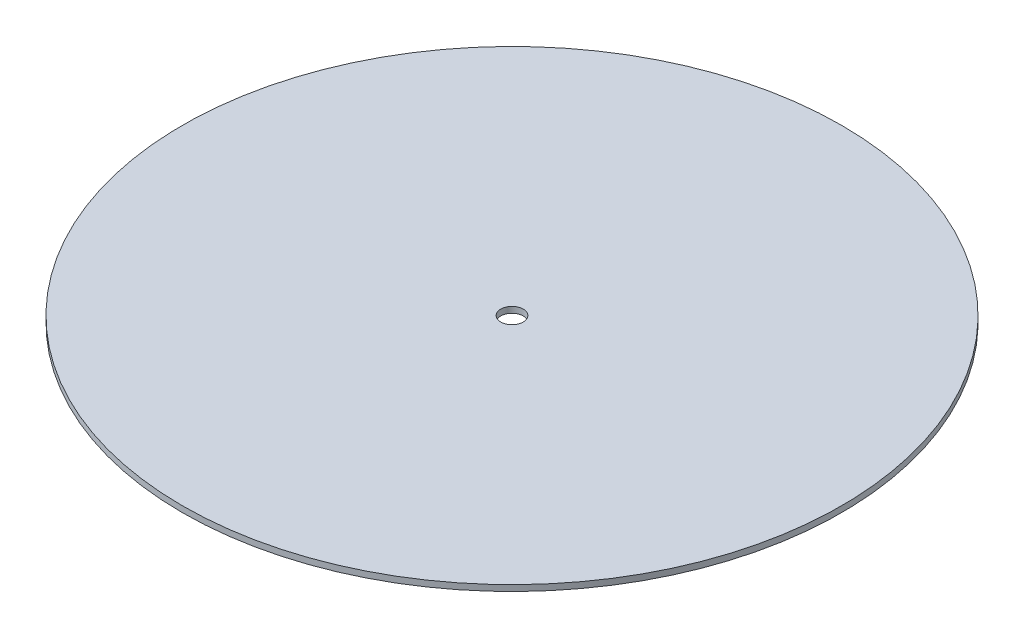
SolidWorks part; units mm, degrees
ref_plane "Front Plane" through (0, 0, 0) normal (0, 0, 1) x (1, 0, 0)
ref_plane "Top Plane" through (0, 0, 0) normal (0, 1, 0) x (1, 0, 0)
ref_plane "Right Plane" through (0, 0, 0) normal (1, 0, 0) x (0, 0, -1)
sketch "Sketch1" plane through (0, 0, 0) normal (0, 1, 0) x (1, 0, 0)
  circle A0 centre (0, 0) radius 110
  circle A1 centre (0, 0) radius 3.75
  dimension "D1" = 220
  dimension "D2" = 7.5
extrude "Boss-Extrude1" add sketch "Sketch1" along normal mid plane 2
